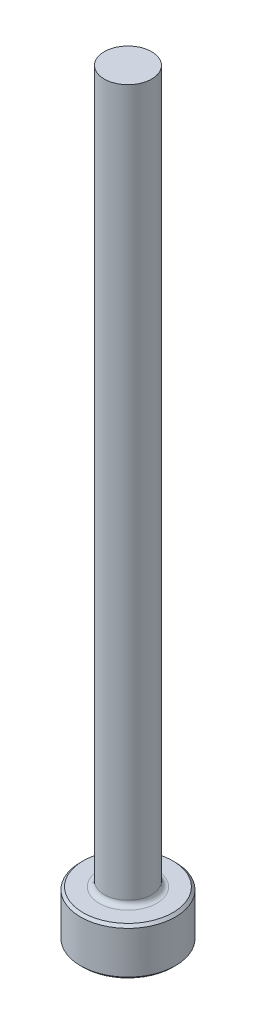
SolidWorks part; units mm, degrees
ref_plane "Front Plane" through (0, 0, 0) normal (0, 0, 1) x (1, 0, 0)
ref_plane "Top Plane" through (0, 0, 0) normal (0, 1, 0) x (1, 0, 0)
ref_plane "Right Plane" through (0, 0, 0) normal (1, 0, 0) x (0, 0, -1)
sketch "Sketch1" plane through (0, 0, 0) normal (0, 0, 1) x (1, 0, 0)
  line L0 (0, 259.9588) -> (0, -15.1925) construction
  line L1 (0, 0) -> (-4.7625, 0)
  line L2 (-4.7625, 0) -> (-4.7625, 4.7498)
  line L3 (-4.7625, 4.7498) -> (-2.3812, 4.7498)
  line L4 (-2.3812, 4.7498) -> (-2.3812, 76.2)
  line L5 (-2.3812, 76.2) -> (0, 76.2)
  line L6 (0, 76.2) -> (0, 0)
  dimension "L" = 76.2
  dimension "H" = 9.525
  dimension "T" = 4.7498
  dimension "D" = 4.7625
revolve "Revolve1" add sketch "Sketch1" angle 360 about L0
chamfer "Chamfer1" distance 0.254 angle 45 2 edges at (0, 4.7498, 4.7625) (0, 0, 4.7625)
fillet "Fillet1" radius 0.508 1 edges at (0, 4.7498, 2.3812)
sketch "Pocket Sketch" plane through (0, 0, 0) normal (0, 0, 1) x (1, 0, 0)
  line L0 (-5.1594, 0) -> (-5.1594, 4.7752)
  line L1 (-5.1594, 4.7752) -> (-3.3417, 4.7752)
  line L2 (-2.5797, 5.5372) -> (-2.5797, 22.225)
  line L3 (-2.5797, 22.225) -> (0, 22.225)
  line L4 (0, 22.225) -> (0, 0)
  line L5 (0, 0) -> (-5.1594, 0)
  line L6 (0, 12.6104) -> (0, -2.4989) construction
  line L7 (-4.7625, 4.4958) -> (-4.7625, 0.254) construction
  line L8 (4.5085, 4.7498) -> (-4.5085, 4.7498) construction
  line L9 (-2.3812, 76.2) -> (-2.3812, 5.2578) construction
  line L10 (-3.3417, 4.7752) -> (-2.5797, 5.5372)
  point P3 (-2.5797, 4.7752)
  dimension "D1" = 10.3187
  dimension "D2" = 0.3969
  dimension "D3" = 0.0254
  dimension "D4" = 0.1984
  dimension "D5" = 5.1594
  dimension "D6" = 22.225
